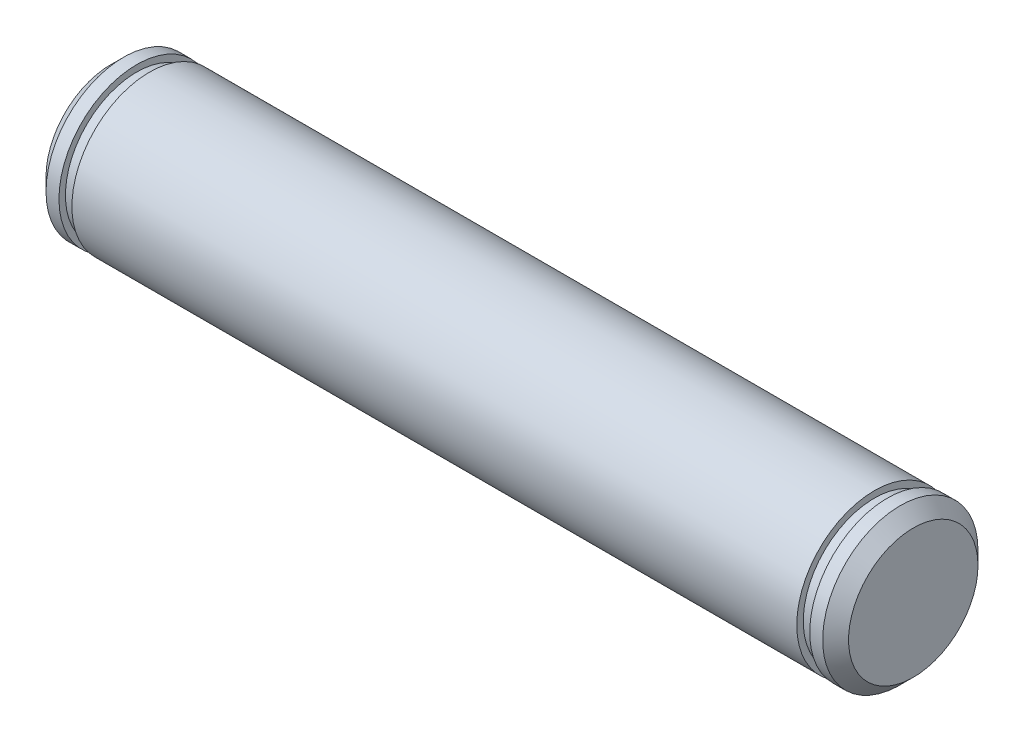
SolidWorks part; units mm, degrees
ref_plane "Plan1" through (0, 0, 0) normal (0, 0, 1) x (1, 0, 0)
ref_plane "Plan2" through (0, 0, 0) normal (0, 1, 0) x (1, 0, 0)
ref_plane "Plan3" through (0, 0, 0) normal (1, 0, 0) x (0, 0, -1)
sketch "Esquisse1" plane through (0, 0, 0) normal (0, 0, 1) x (1, 0, 0)
  line L0 (40, 0) -> (-90, 0) construction
  line L1 (0, 0) -> (-62, 0)
  line L2 (0, 0) -> (0, 6)
  line L3 (0, 6) -> (-62, 6)
  line L4 (-62, 0) -> (-62, 6)
  dimension "D1" = 6
  dimension "D2" = 62
revolve "Base-Révolution" add sketch "Esquisse1" angle 360 about L0
chamfer "Chanfrein1" distance 1 angle 45
sketch "Esquisse2" plane through (0, 0, 0) normal (0, 0, 1) x (1, 0, 0)
  line L0 (-1, -6) -> (-1, 6) construction
  line L1 (-2, 10) -> (-3, 10)
  line L2 (-2, 10) -> (-2, 5.5)
  line L3 (-2, 5.5) -> (-3, 5.5)
  line L4 (-3, 10) -> (-3, 5.5)
  line L5 (-1, 6) -> (-61, 6) construction
  line L6 (0, 0) -> (-62.2706, 0) construction
  line L7 (-1, 0) -> (0, 0) construction
  dimension "D1" = 1
  dimension "D2" = 1
  dimension "D3" = 0.5
revolve "Enlèvement de matière-Révolution1" cut sketch "Esquisse2" angle 360 about L6
sketch "Esquisse3" plane through (0, 0, 0) normal (0, 0, 1) x (1, 0, 0)
  line L0 (-61, -6) -> (-61, 6) construction
  line L1 (-60, 10) -> (-59, 10)
  line L2 (-60, 10) -> (-60, 5.5)
  line L3 (-60, 5.5) -> (-59, 5.5)
  line L4 (-59, 10) -> (-59, 5.5)
  line L5 (-3, 6) -> (-61, 6) construction
  line L6 (0, 0) -> (-70, 0) construction
  line L7 (-1, 0) -> (0, 0) construction
  dimension "D1" = 1
  dimension "D2" = 1
  dimension "D3" = 0.5
revolve "Enlèvement de matière-Révolution2" cut sketch "Esquisse3" angle 360 about L6
